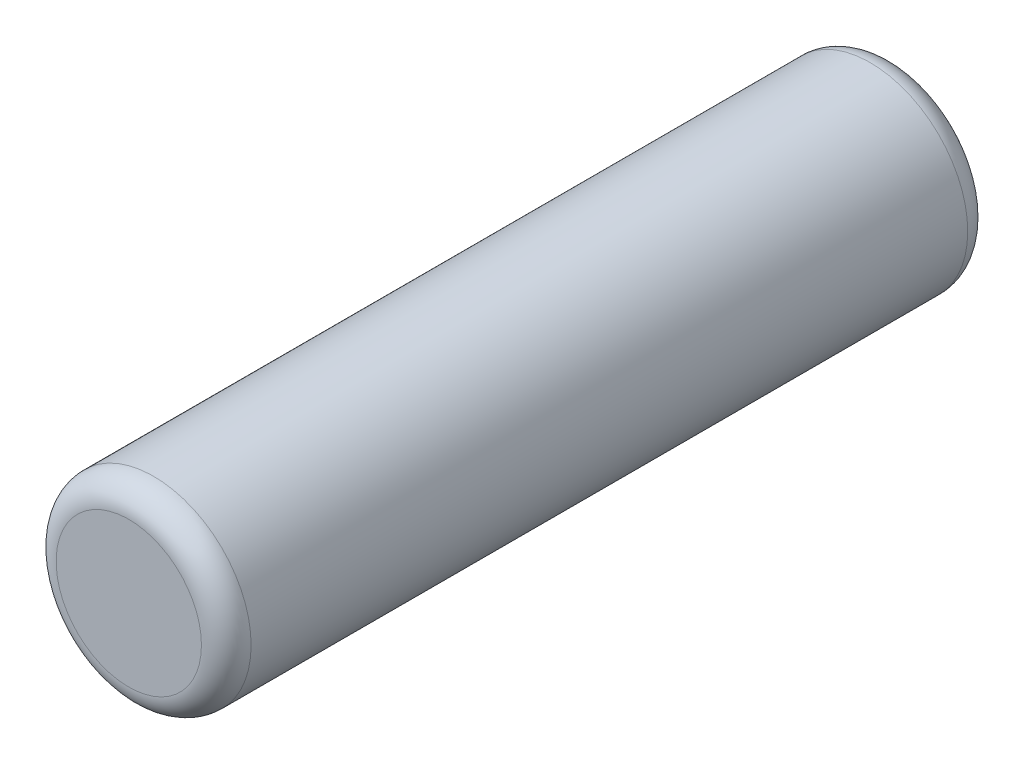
SolidWorks part; units mm, degrees
extrude "Base-Extrude" add sketch "Sketch1" along normal mid plane 15.6718
sketch "Sketch1" plane through (0, 0, 0) normal (0, 0, 1) x (1, 0, 0)
  circle A0 centre (0, 0) radius 1.9939
  dimension "D1" = 3.9878
fillet "Fillet1" radius 0.508 2 edges at (1.9939, 0, 7.8359) (1.9939, 0, -7.8359)
ref_plane "Plane1" through (0, 0, 0) normal (0, 0, 1) x (1, 0, 0)
ref_plane "Plane2" through (0, 0, 0) normal (0, 1, 0) x (-1, 0, 0)
ref_plane "Plane3" through (0, 0, 0) normal (1, 0, 0) x (0, 0, -1)
